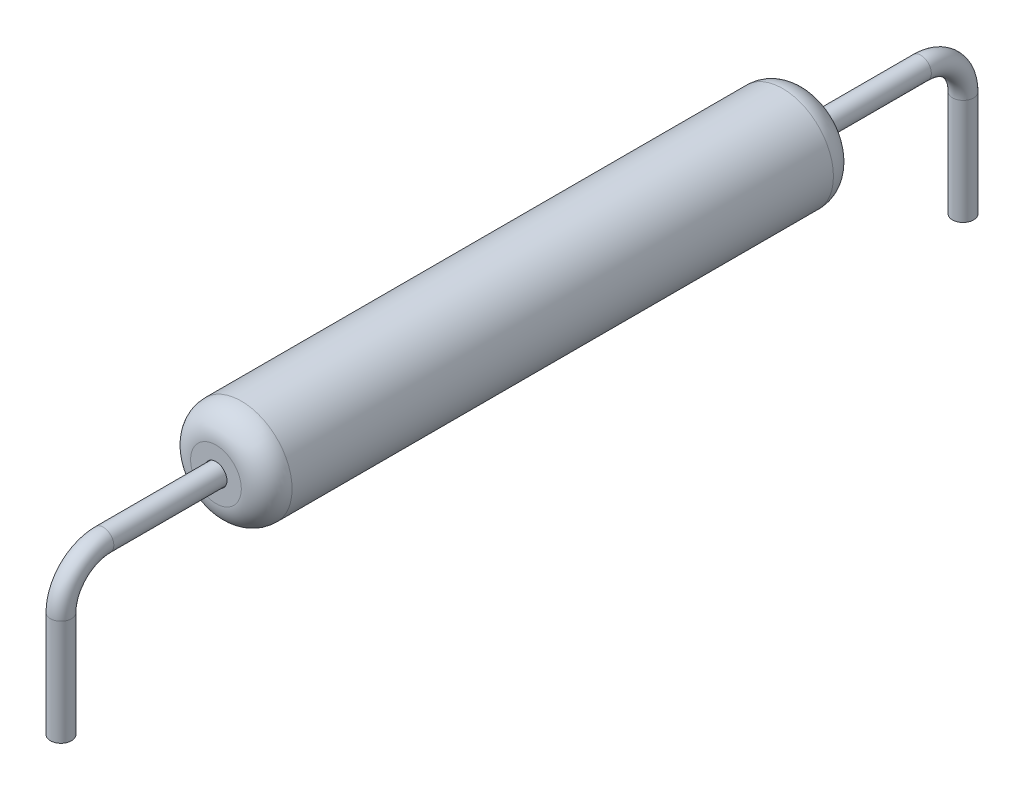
SolidWorks part; units mm, degrees
ref_plane "Plan de face" through (0, 0, 0) normal (0, 0, 1) x (1, 0, 0)
ref_plane "Plan de dessus" through (0, 0, 0) normal (0, 1, 0) x (1, 0, 0)
ref_plane "Plan de droite" through (0, 0, 0) normal (1, 0, 0) x (0, 0, -1)
sketch "Esquisse1" plane through (0, 0, 0) normal (0, 0, 1) x (1, 0, 0)
  circle A0 centre (0, 0) radius 1.2
  circle A1 centre (0, 0) radius 0.26
extrude "Extrusion1" add sketch "Esquisse1" along normal blind 14
ref_plane "Plan1" through (0, 0, 7) normal (0, 0, 1) x (1, 0, 0)
ref_plane "Plan2" through (0, 0, 0) normal (1, 0, 0) x (0, 0, -1)
sketch "Esquisse2" plane through (0, 0, 0) normal (1, 0, 0) x (0, 0, -1)
  line L0 (-7, -2.5092) -> (-7, 3.6583) construction
  line L1 (-5.9091, 0) -> (-18.4874, 0) construction
  line L2 (-12.3529, -3.5) -> (-18.4874, -3.5) construction
  line L3 (-17.665, 6.5039) -> (-17.665, -4.3612) construction
  line L4 (0, -1.2) -> (0, 1.2) construction
  line L5 (-7, 0) -> (-16.665, 0)
  line L6 (-17.665, -3.5) -> (-17.665, -1)
  arc A0 (-16.665, 0) -> (-17.665, -1) centre (-16.665, -1) ccw
  dimension "D4" = 1
  dimension "D1" = 7
  dimension "D2" = 10.665
  dimension "D3" = 3.5
sketch "Esquisse3" plane through (0, 0, 7) normal (0, 0, 1) x (1, 0, 0)
  circle A0 centre (0, 0) radius 0.25
sweep "Balayage1" add profiles "Esquisse3" path "Esquisse2"
mirror "Symétrie1" about plane through (0, 0, 7) normal (0, 0, 1) of "Balayage1"
fillet "Congé1" radius 0.6 2 edges at (1.2, 0, 0) (1.2, 0, 14)
